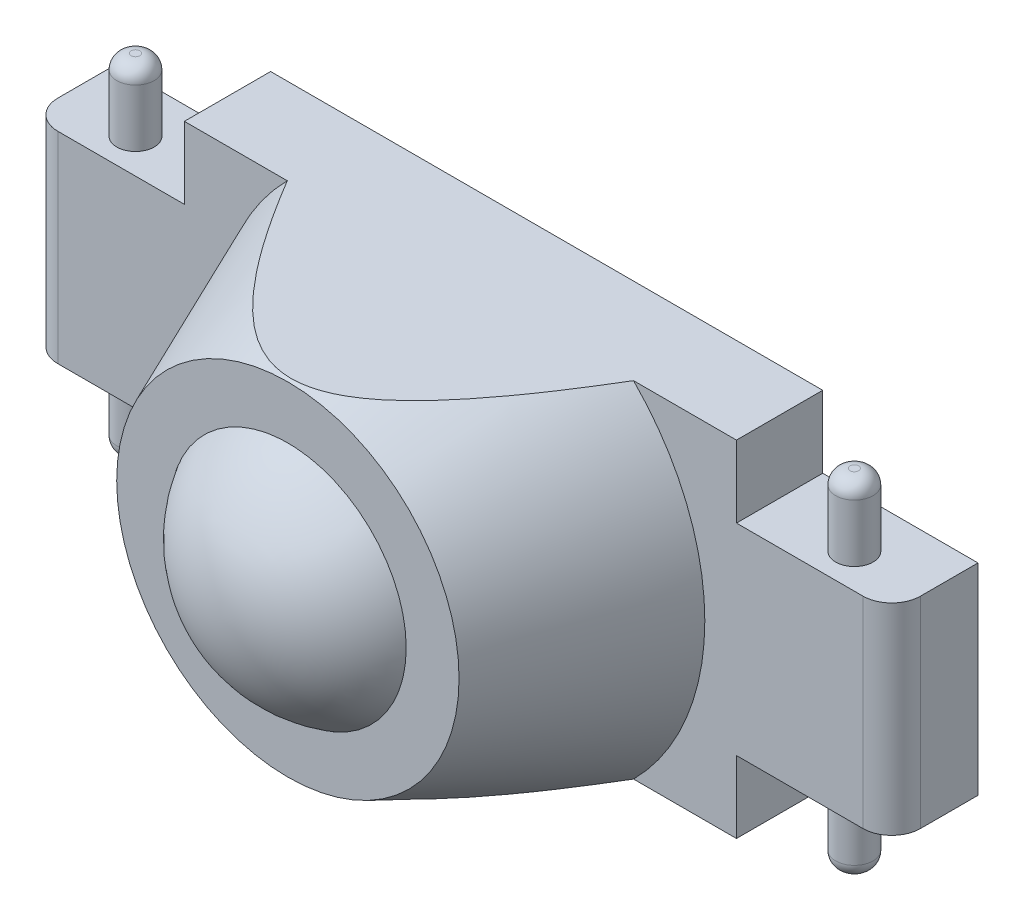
SolidWorks part; units mm, degrees
ref_plane "Plan de face" through (0, 0, 0) normal (0, 0, 1) x (1, 0, 0)
ref_plane "Plan de dessus" through (0, 0, 0) normal (0, 1, 0) x (1, 0, 0)
ref_plane "Plan de droite" through (0, 0, 0) normal (1, 0, 0) x (0, 0, -1)
sketch "Esquisse1" plane through (0, 0, 0) normal (0, 0, 1) x (1, 0, 0)
  line L0 (-15, -3.5) -> (15, 3.5) construction
  line L1 (-15, 3.5) -> (-9.6, 3.5)
  line L2 (-15, 3.5) -> (-15, -3.5)
  line L3 (-15, -3.5) -> (-9.6, -3.5)
  line L4 (15, 3.5) -> (15, -3.5)
  line L5 (9.6, 6) -> (-9.6, -6) construction
  line L6 (-9.6, 6) -> (9.6, 6)
  line L7 (-9.6, 6) -> (-9.6, 3.5)
  line L8 (-9.6, -6) -> (9.6, -6)
  line L9 (9.6, 6) -> (9.6, 3.5)
  line L10 (9.6, 3.5) -> (15, 3.5)
  line L11 (-9.6, -3.5) -> (-9.6, -6)
  line L12 (9.6, -3.5) -> (15, -3.5)
  line L13 (9.6, -3.5) -> (9.6, -6)
  circle A0 centre (0, 0) radius 4.775
  dimension "D5" = 9.55
  dimension "D1" = 7
  dimension "D2" = 30
  dimension "D3" = 12
  dimension "D4" = 19.2
extrude "Boss.-Extru.1" add sketch "Esquisse1" along normal blind 3
sketch "Esquisse3" plane through (0, 0, 3) normal (0, 0, 1) x (1, 0, 0)
  circle A0 centre (0, 0) radius 8.5
  dimension "D1" = 17
extrude "Boss.-Extru.2" add sketch "Esquisse3" along normal blind 6 draft 23
sketch "Esquisse4" plane through (0, 0, 3) normal (0, 0, -1) x (-1, 0, 0)
  line L0 (-6.0208, 6) -> (6.0208, 6) construction
  line L1 (6.0208, -6) -> (-6.0208, -6)
  line L2 (6.0208, -6) -> (-6.0208, -6)
  line L3 (-6.0208, 6) -> (6.0208, 6)
  arc A0 (6.0208, 6) -> (-6.0208, 6) centre (0, 0) ccw construction
  arc A1 (-6.0208, -6) -> (6.0208, -6) centre (0, 0) ccw
  arc A2 (-6.0208, -6) -> (6.0208, -6) centre (0, 0) ccw
  arc A3 (6.0208, 6) -> (-6.0208, 6) centre (0, 0) ccw
  dimension "D1" = 0
extrude "Enlèv. mat.-Extru.1" cut sketch "Esquisse4" against normal through all
sketch "Esquisse6" plane through (0, 0, 0) normal (0, 1, 0) x (1, 0, 0)
  line L0 (0, 0) -> (0, -6.575) construction
  line L1 (-4.775, 0) -> (-4.775, -3) construction
  line L2 (0, -11.35) -> (-6.0031, -11.35) construction
  line L3 (9.6, 0) -> (-9.6, 0) construction
  line L4 (-4.775, -3) -> (-4.775, 0)
  line L5 (4.775, -3) -> (-4.775, -3) construction
  line L6 (-4.775, -3) -> (-4.775, -6.575)
  line L7 (-4.775, 0) -> (0, 0)
  line L8 (0, -6.575) -> (0, -11.35) construction
  line L9 (0, 0) -> (0, -11.35)
  arc A0 (-4.775, -6.575) -> (0, -11.35) centre (0, -6.575) ccw
  dimension "D1" = 11.35
revolve "Enlèvement de matière-Révolution1" cut sketch "Esquisse6" angle 360 about L9
sketch "Esquisse7" plane through (0, 0, 0) normal (0, 1, 0) x (1, 0, 0)
  line L0 (0, 0) -> (0, 7.4595) construction
  line L1 (-15, 0) -> (-9.6, 0) construction
  circle A0 centre (-12.5, -1.8) radius 0.65
  circle A1 centre (12.5, -1.8) radius 0.65
  dimension "D1" = 1.3
  dimension "D2" = 25
  dimension "D3" = 1.8
extrude "Enlèv. mat.-Extru.2" cut sketch "Esquisse7" against normal mid plane 30
fillet "Congé1" radius 1 2 edges at (-15, 0, 3) (15, 0, 3)
sketch "Esquisse8" plane through (0, 0, 0) normal (0, 1, 0) x (1, 0, 0)
  line L0 (0, 0) -> (0, -11.35) construction
  line L1 (0, -11.35) -> (0, -1.8)
  line L2 (0, -1.8) -> (-4.275, -1.8)
  line L3 (-4.775, -2.3) -> (-4.775, -6.575)
  arc A0 (-4.775, -6.575) -> (0, -11.35) centre (0, -6.575) ccw
  arc A1 (-4.775, -6.575) -> (-4.1134, -9) centre (0, -6.575) ccw construction
  arc A2 (-4.275, -1.8) -> (-4.775, -2.3) centre (-4.275, -2.3) ccw
  dimension "D1" = 0.5
revolve "Révolution1" add sketch "Esquisse8" angle 360 about L1
sketch "Esquisse9" plane through (0, 0, 0) normal (0, 1, 0) x (1, 0, 0)
  circle A0 centre (-12.5, -1.8) radius 0.65 construction
  circle A1 centre (12.5, -1.8) radius 0.65 construction
  circle A2 centre (-12.5, -1.8) radius 0.65
  circle A3 centre (12.5, -1.8) radius 0.65
extrude "Boss.-Extru.3" add sketch "Esquisse9" along normal mid plane 12 separate body
fillet "Congé2" radius 0.5 2 edges at (-12.5, 6, 2.45) (-12.5, -6, 2.45)
fillet "Congé3" radius 0.5 2 edges at (12.5, -6, 2.45) (12.5, 6, 2.45)
